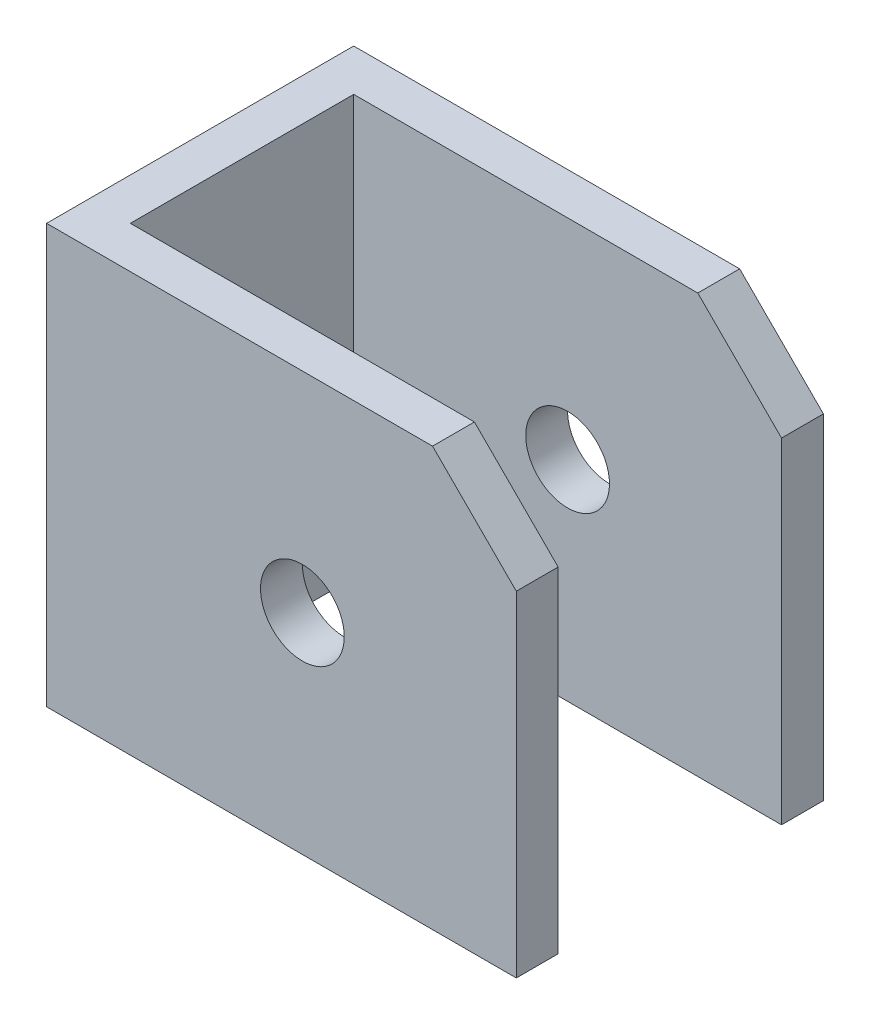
SolidWorks part; units mm, degrees
ref_plane "Front Plane" through (0, 0, 0) normal (0, 0, 1) x (1, 0, 0)
ref_plane "Top Plane" through (0, 0, 0) normal (0, 1, 0) x (1, 0, 0)
ref_plane "Right Plane" through (0, 0, 0) normal (1, 0, 0) x (0, 0, -1)
sketch "Sketch1" plane through (0, 0, 0) normal (0, 1, 0) x (1, 0, 0)
  line L1 (-28.0427, 18.3355) -> (28.0427, 18.3355)
  line L2 (-28.0427, 18.3355) -> (-28.0427, -18.3355)
  line L3 (-28.0427, -18.3355) -> (28.0427, -18.3355)
  line L4 (28.0427, 18.3355) -> (28.0427, -18.3355) construction
  line L5 (-28.0427, 18.3355) -> (28.0427, -18.3355) construction
  line L6 (-28.0427, -18.3355) -> (28.0427, 18.3355) construction
  point P0 (0, 0)
  dimension "D1" = 56.0854
  dimension "D2" = 36.6709
extrude "Extrude-Thin1" add sketch "Sketch1" along normal blind 50 thin
hole_wizard "Ø10.0 (10) Diameter Hole1" positions "Sketch2" profile "Sketch3" hole size "Ø10.0" standard "ANSI Metric"
sketch "Sketch2" plane through (0, 0, 18.3355) normal (0, 0, 1) x (1, 0, 0)
  line L0 (28.0427, 50) -> (-23.0427, 0) construction
  point P0 (2.5, 25)
sketch "Sketch3" plane through (2.5, 25, 18.3355) normal (1, 0, 0) x (0, -1, 0)
  line L0 (0, 0) -> (0, 36.6709)
  line L1 (0, 36.6709) -> (5, 36.6709)
  line L2 (5, 36.6709) -> (5, 0)
  line L5 (5, 0) -> (0, 0)
  line L11 (0, -6.35) -> (0, 107.95) construction
  dimension "Thru Hole Dia." = 10
  dimension "Thru Hole Depth" = 36.6709
chamfer "Chamfer1" distance 10 angle 45 2 edges at (28.0427, 50, -15.8355) (28.0427, 50, 15.8355)
